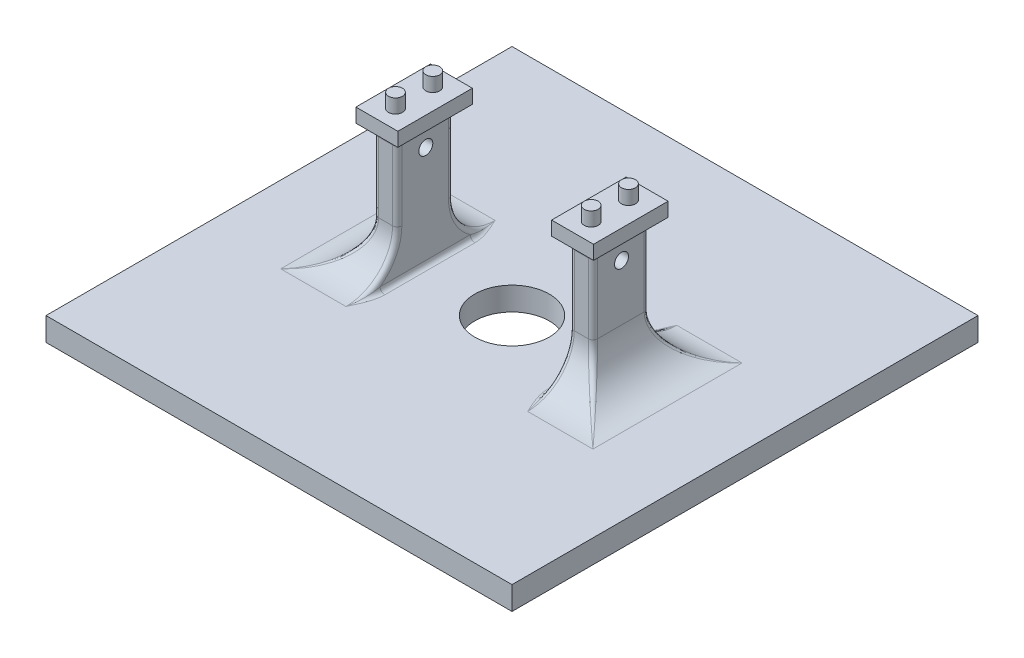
SolidWorks part; units mm, degrees
ref_plane "Front Plane" through (0, 0, 0) normal (0, 0, 1) x (1, 0, 0)
ref_plane "Top Plane" through (0, 0, 0) normal (0, 1, 0) x (1, 0, 0)
ref_plane "Right Plane" through (0, 0, 0) normal (1, 0, 0) x (0, 0, -1)
sketch "Sketch1" plane through (0, 0, 0) normal (0, 1, 0) x (1, 0, 0)
  line L1 (-50, -50) -> (50, -50)
  line L2 (-50, -50) -> (-50, 50)
  line L3 (-50, 50) -> (50, 50)
  line L4 (50, -50) -> (50, 50)
  line L5 (-50, -50) -> (50, 50) construction
  line L6 (-50, 50) -> (50, -50) construction
  point P0 (0, 0)
  dimension "D1" = 100
  dimension "D2" = 100
extrude "Boss-Extrude1" add sketch "Sketch1" along normal blind 5
sketch "Sketch2" plane through (0, 5, 0) normal (0, 1, 0) x (1, 0, 0)
  line L0 (-7.9792, -0.1363) -> (28.4101, -0.1363) construction
  line L2 (-23.5, -6.1363) -> (-18.5, -6.1363)
  line L3 (-23.5, -6.1363) -> (-23.5, 5.8637)
  line L4 (-23.5, 5.8637) -> (-18.5, 5.8637)
  line L5 (-18.5, -6.1363) -> (-18.5, 5.8637)
  line L6 (-23.5, -6.1363) -> (-18.5, 5.8637) construction
  line L7 (-23.5, 5.8637) -> (-18.5, -6.1363) construction
  point P1 (-21, -0.1363)
  dimension "D1" = 5
  dimension "D2" = 12
  dimension "D3" = 18.5
extrude "Boss-Extrude2" add sketch "Sketch2" along normal blind 27
sketch "Sketch3" plane through (-23.5, 0, 0) normal (-1, 0, 0) x (0, 0, 1)
  line L0 (-5.8637, 32) -> (6.1363, 32) construction
  circle A0 centre (0, 27) radius 1.5
  dimension "D2" = 3
  dimension "D1" = 5
extrude "Cut-Extrude2" cut sketch "Sketch3" against normal blind 5
sketch "Sketch5" plane through (0, 32, 0) normal (0, 1, 0) x (1, 0, 0)
  line L0 (-21, 5.8637) -> (-21, -15.3848) construction
  line L1 (-18.5, 5.8637) -> (-23.5, 5.8637) construction
  line L3 (-25.5, -8) -> (-16.5, -8)
  line L4 (-25.5, -8) -> (-25.5, 8)
  line L5 (-25.5, 8) -> (-16.5, 8)
  line L6 (-16.5, -8) -> (-16.5, 8)
  line L7 (-25.5, -8) -> (-16.5, 8) construction
  line L8 (-25.5, 8) -> (-16.5, -8) construction
  point P4 (-21, 0)
  dimension "D1" = 16
  dimension "D2" = 9
extrude "Boss-Extrude3" add sketch "Sketch5" along normal blind 3
sketch "Sketch6" plane through (0, 35, 0) normal (0, 1, 0) x (1, 0, 0)
  line L0 (-21, 8) -> (-21, -11.3003) construction
  line L1 (-16.5, 8) -> (-25.5, 8) construction
  line L2 (-21, 0) -> (-8.9022, 0) construction
  line L3 (-8.9022, 0) -> (-27.4201, 0) construction
  circle A0 centre (-21, 4) radius 1.5
  circle A1 centre (-21, -4) radius 1.5
  dimension "D1" = 3
  dimension "D2" = 4
extrude "Boss-Extrude4" add sketch "Sketch6" along normal blind 3
sketch "Sketch4" plane through (0, 5, 0) normal (0, 1, 0) x (1, 0, 0)
  circle A0 centre (0, 0) radius 8
  dimension "D1" = 16
extrude "Cut-Extrude3" cut sketch "Sketch4" against normal blind 5
mirror "Mirror2" about plane through (0, 0, 0) normal (1, 0, 0) of "Boss-Extrude4", "Boss-Extrude3", "Boss-Extrude2", "Cut-Extrude2"
fillet "Fillet1" radius 2 8 edges at (21, 32, -5.8637) (18.5, 32, 0.1363) (21, 32, 6.1363) (23.5, 32, 0.1363) (-18.5, 32, 0.1363) (-21, 32, -5.8637) (-23.5, 32, 0.1363) (-21, 32, 6.1363)
fillet "Fillet2" radius 10 6 edges at (21, 5, -5.8637) (-21, 5, -5.8637) (-21, 5, 6.1363) (21, 5, 6.1363) (23.5, 5, 0.1363) (-23.5, 5, 0.1363)
fillet "Fillet4" radius 1 30 edges at (24.0858, 31.4142, -6.4495) (26.4289, 7.9289, -8.7926) (17.061, 31.9197, 7.5597) (18.5, 30.0023, 6.1363) (18.5, 7.9289, 9.0653) (24.939, 31.9197, 7.5597) (23.5, 30.0023, 6.1363) (26.4289, 7.9289, 9.0653) (17.9142, 31.4142, -6.4495) (18.5, 7.9289, -8.7926) (-17.1612, 31.8875, 7.462) (-18.5, 30.0023, 6.1363) (-18.5, 22.5, 6.1363) (-17.9142, 31.4142, -6.4495) (-18.5, 7.9289, -8.7926) (-24.0858, 31.4142, -6.4495) (-26.4289, 7.9289, -8.7926) (-24.939, 31.9197, 7.5597) (-23.5, 30.0023, 6.1363) (-26.4289, 7.9289, 9.0653) (23.5, 22.5, -5.8637) (18.5, 22.5, 6.1363) (23.5, 22.5, 6.1363) (18.5, 5, 0.1363) (18.5, 22.5, -5.8637) (-18.5, 7.9289, 9.0653) (-18.5, 22.5, -5.8637) (-18.5, 5, 0.1363) (-23.5, 22.5, -5.8637) (-23.5, 22.5, 6.1363)
